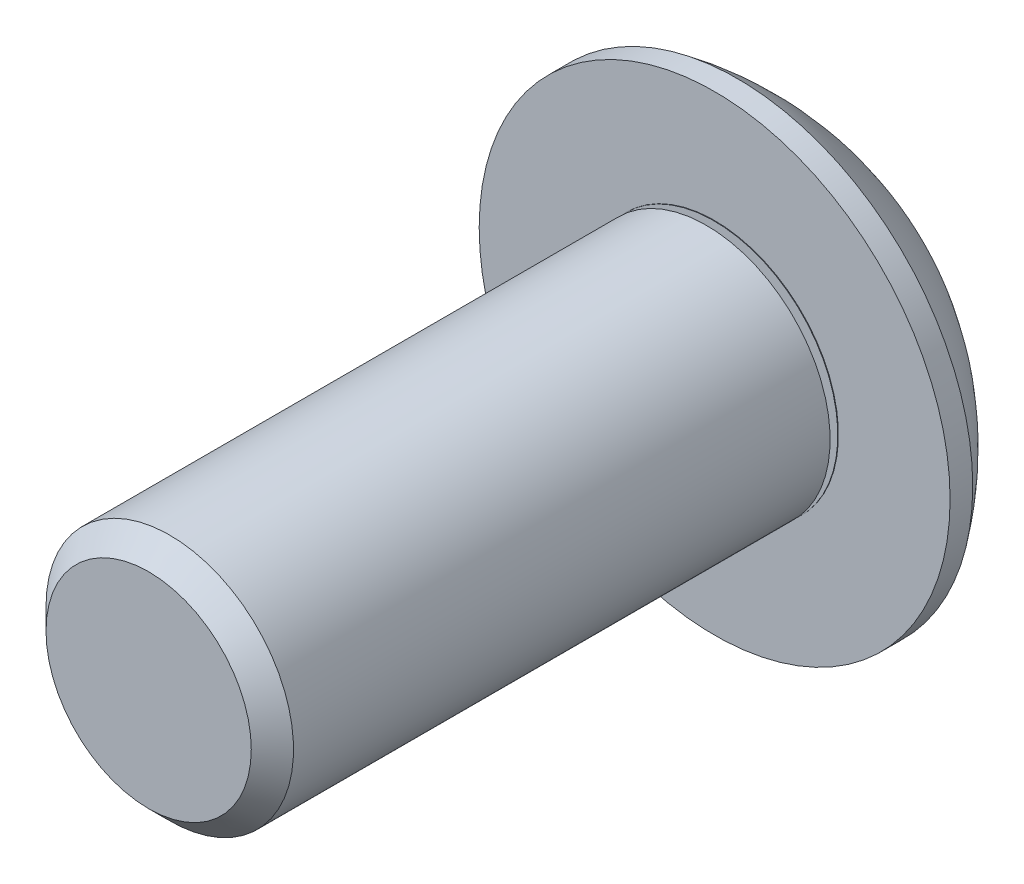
SolidWorks part; units mm, degrees
ref_plane "Front" through (0, 0, 0) normal (0, 0, 1) x (1, 0, 0)
ref_plane "Top" through (0, 0, 0) normal (0, 1, 0) x (1, 0, 0)
ref_plane "Right" through (0, 0, 0) normal (1, 0, 0) x (0, 0, -1)
sketch "Logo3_Revol_Axis" plane through (0, 0, 0) normal (0, 1, 0) x (1, 0, 0)
  line L0 (0, -43.5172) -> (0, 43.5172) construction
sketch "Logo3_bib1" plane through (0, 0, 0) normal (0, -1, 0) x (-1, 0, 0)
  line L0 (0, -9.525) -> (0, 2.2098)
  line L1 (0, 2.2098) -> (1.4923, 2.2098)
  line L2 (3.9624, 0.381) -> (3.9624, 0)
  line L3 (3.9624, 0) -> (2.0828, 0)
  line L4 (2.0828, 0) -> (2.0828, -0.01)
  line L5 (2.0828, -9.1694) -> (1.7272, -9.525)
  line L6 (1.7272, -9.525) -> (0, -9.525)
  line L7 (2.0828, -0.01) -> (1.8406, -0.01)
  line L8 (1.8338, -0.0488) -> (2.0828, -0.1394)
  line L9 (2.0828, -0.1394) -> (2.0828, -9.1694)
  line L10 (0, 10.5852) -> (0, -63.2873) construction
  arc A1 (1.8406, -0.01) -> (1.8338, -0.0488) centre (1.8406, -0.03) ccw
  arc A2 (3.9624, 0.381) -> (1.4923, 2.2098) centre (-0.1538, -2.5961) ccw
  point P17 (1.7272, -0.01)
revolve "Revolve1" add sketch "Logo3_bib1" angle 360 about L10
sketch "Logo3_bib2" plane through (0, 0, -2.2098) normal (0, 0, -1) x (1, 0, 0)
  line L1 (1.3755, 0) -> (0.6878, 1.1913)
  line L2 (0.6878, 1.1913) -> (-0.6878, 1.1913)
  line L3 (-0.6878, 1.1913) -> (-1.3755, 0)
  line L4 (-1.3755, 0) -> (-0.6878, -1.1913)
  line L5 (-0.6878, -1.1913) -> (0.6878, -1.1913)
  line L6 (0.6878, -1.1913) -> (1.3755, 0)
  circle A0 centre (0, 0) radius 1.1913 construction
  dimension "Logo3_c1" = 2.3825
extrude "Cut-Extrude1" cut sketch "Logo3_bib2" against normal blind 1.3208
equation "\"DIA2@Logo3_bib1\" = \"Logo3_d1-pas@Logo3_bib1\""
equation "\"D2@Cosmetic Thread1\" = \"Logo3_d1-pas@Logo3_bib1\""
